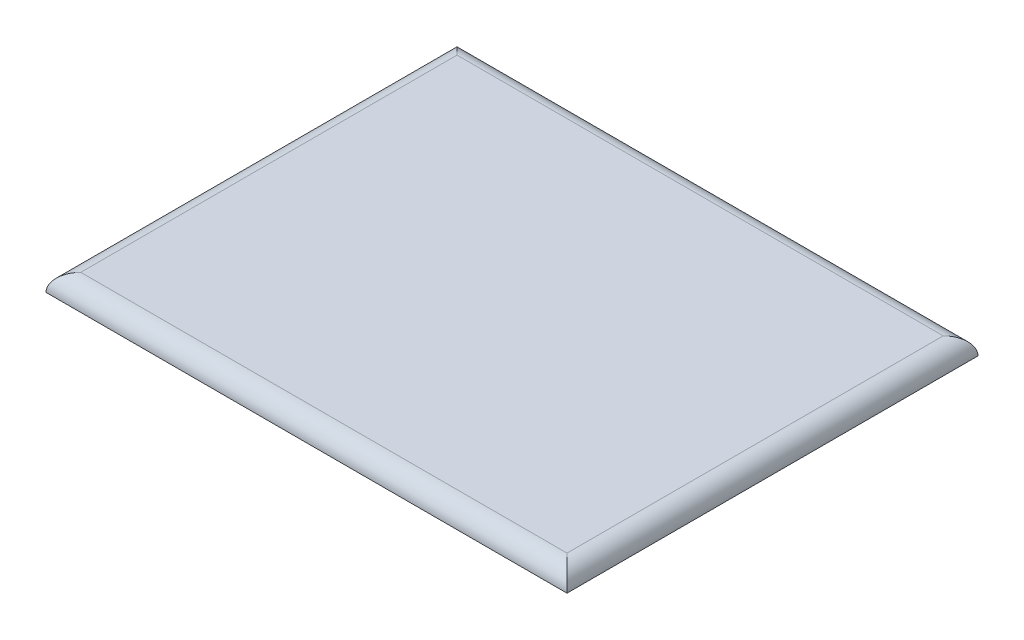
SolidWorks part; units mm, degrees
ref_plane "Front Plane" through (0, 0, 0) normal (0, 0, 1) x (1, 0, 0)
ref_plane "Top Plane" through (0, 0, 0) normal (0, 1, 0) x (1, 0, 0)
ref_plane "Right Plane" through (0, 0, 0) normal (1, 0, 0) x (0, 0, -1)
sketch "Sketch1" plane through (0, 0, 0) normal (0, 1, 0) x (1, 0, 0)
  line L1 (-54.7834, 37.8189) -> (35.2166, 37.8189)
  line L2 (-54.7834, 37.8189) -> (-54.7834, -33.1811)
  line L3 (-54.7834, -33.1811) -> (35.2166, -33.1811)
  line L4 (35.2166, 37.8189) -> (35.2166, -33.1811)
extrude "Boss-Extrude1" add sketch "Sketch1" along normal blind 3
sketch "Sketch2" plane through (0, 3, 0) normal (0, 1, 0) x (1, 0, 0)
  line L0 (35.2166, -33.1811) -> (35.2166, -28.1811) construction
  line L1 (35.2166, -33.1811) -> (35.2166, 37.8189) construction
  line L2 (35.2166, -28.1811) -> (40.2166, -28.1811) construction
fillet "Fillet4" radius 3 4 edges at (-9.7834, 3, -37.8189) (35.2166, 3, -2.3189) (-9.7834, 3, 33.1811) (-54.7834, 3, -2.3189)
